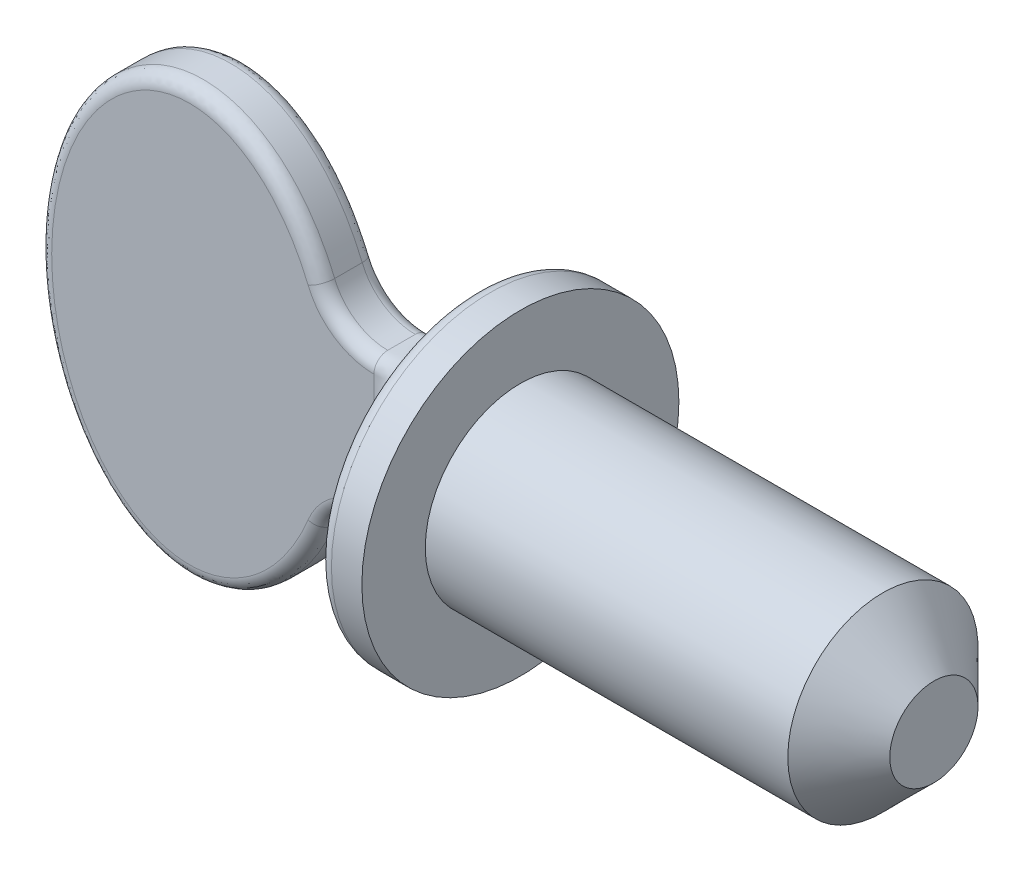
SolidWorks part; units mm, degrees
ref_plane "Front Plane" through (0, 0, 0) normal (0, 0, 1) x (1, 0, 0)
ref_plane "Top Plane" through (0, 0, 0) normal (0, 1, 0) x (1, 0, 0)
ref_plane "Right Plane" through (0, 0, 0) normal (1, 0, 0) x (0, 0, -1)
sketch "layout" plane through (0, 0, 0) normal (0, 0, 1) x (1, 0, 0)
  line L0 (0, 0) -> (13.208, 0) construction
  line L1 (5.588, 2.921) -> (5.588, -2.921)
  line L2 (3.3976, 1.3123) -> (4.8921, 1.3123) construction
  line L3 (5.588, 2.921) -> (4.7897, 2.921)
  line L4 (4.7897, 2.921) -> (4.7897, 3.2655) construction
  line L5 (4.2865, 1.706) -> (4.2865, 0)
  line L6 (4.2865, 1.706) -> (3.3355, 0.7551) construction
  line L7 (13.208, 1.7526) -> (13.208, 0)
  line L8 (3.3976, 1.3123) -> (3.3976, -1.3123)
  line L9 (13.208, 1.7526) -> (5.588, 1.7526)
  arc A0 (3.3976, 1.3123) -> (2.4197, 1.9685) centre (3.3976, 2.3692) cw
  arc A1 (4.7897, 2.921) -> (4.2865, 1.706) centre (3.0715, 2.921) cw
  arc A2 (3.3976, -1.3123) -> (2.4197, -1.9685) centre (3.3976, -2.3692) ccw
  ellipse E0 centre (0, 0) end of major axis (0, 3.937) minor radius 2.794 (2.4197, 1.9685) -> (2.4197, -1.9685) ccw
sketch "Sketch3" plane through (0, 0, 0) normal (0, 0, 1) x (1, 0, 0)
  line L0 (3.3976, 1.3123) -> (3.3976, -1.3123) construction
  line L1 (3.3976, 1.3123) -> (3.3976, -1.3123)
  arc A0 (3.3976, -1.3123) -> (2.4197, -1.9685) centre (3.3976, -2.3692) ccw construction
  arc A1 (2.4197, 1.9685) -> (3.3976, 1.3123) centre (3.3976, 2.3692) ccw construction
  arc A2 (3.3976, -1.3123) -> (2.4197, -1.9685) centre (3.3976, -2.3692) ccw
  arc A3 (2.4197, 1.9685) -> (3.3976, 1.3123) centre (3.3976, 2.3692) ccw
  ellipse E0 centre (0, 0) end of major axis (0, 3.937) minor radius 2.794 (2.4197, 1.9685) -> (2.4197, -1.9685) ccw construction
  ellipse E1 centre (0, 0) end of major axis (0, 3.937) minor radius 2.794 (2.4197, 1.9685) -> (2.4197, -1.9685) ccw
extrude "Extrude1" add sketch "Sketch3" along normal mid plane 1.016
fillet "Fillet1" radius 0.254 6 edges at (2.8088, 1.4916, -0.508) (2.8088, -1.4916, -0.508) (2.8088, 1.4916, 0.508) (2.8088, -1.4916, 0.508) (-2.794, 0, -0.508) (-2.794, 0, 0.508)
sketch "Sketch4" plane through (0, 0, 0) normal (0, 0, 1) x (1, 0, 0)
  line L0 (13.208, 1.7526) -> (13.208, 0) construction
  line L1 (13.208, 1.7526) -> (5.588, 1.7526) construction
  line L2 (5.588, 2.921) -> (5.588, -2.921) construction
  line L3 (5.588, 2.921) -> (4.7897, 2.921) construction
  line L4 (4.2865, 1.706) -> (4.2865, 0) construction
  line L5 (13.208, 0.8128) -> (13.208, 0)
  line L6 (12.2682, 1.7526) -> (5.588, 1.7526)
  line L7 (5.588, 2.921) -> (5.588, 1.7526)
  line L8 (5.588, 2.921) -> (4.7897, 2.921)
  line L9 (4.2865, 1.706) -> (4.2865, 0)
  line L10 (0, 0) -> (16.8942, 0) construction
  line L11 (13.208, 0) -> (4.2865, 0)
  line L12 (12.2682, 1.7526) -> (13.208, 0.8128)
  line L15 (12.2682, -1.7526) -> (13.208, -0.8128) construction
  arc A0 (4.2865, 1.706) -> (4.7897, 2.921) centre (3.0715, 2.921) ccw construction
  arc A1 (4.2865, 1.706) -> (4.7897, 2.921) centre (3.0715, 2.921) ccw
revolve "Revolve1" add sketch "Sketch4" angle 360 about L10
loft "Loft1" add
fillet "Fillet2" radius 0.254 1 edges at (4.7897, 0, 2.921)
sketch "Sketch5" plane through (0, 0, 0) normal (0, 1, 0) x (1, 0, 0)
  line L0 (11.7227, 2.2981) -> (12.2682, 2.2981)
  line L1 (12.2682, 2.2981) -> (12.2682, 1.7526)
  line L2 (12.2682, 1.7526) -> (11.9954, 1.2802)
  line L3 (11.9954, 1.2802) -> (11.7227, 1.7526)
  line L5 (11.7227, 1.7526) -> (11.7227, 2.2981)
  line L7 (-3.6147, 0) -> (14.1406, 0) construction
revolve "Cut-Revolve10" [suppressed] cut sketch "Sketch5" angle 360 about L7
pattern_linear "LPattern10" [suppressed] count 8 along (1, 0, 0)
equation "\"D4@layout\" = \"Head Height@layout\" / 3 * 2"
equation "\"D5@layout\" = \"Head Width@layout\" / 3"
equation "\"D6@layout\" = \"Head Width@layout\" / 2"
equation "\"D7@layout\" = \"D5@layout\" * 1.3"
equation "\"D8@layout\" = \"D4@layout\"  / 7"
equation "\"D1@Fillet1\" = \"Head Thickness@Extrude1\" / 4"
equation "\"D1@Fillet2\" = \"D1@Fillet1\""
equation "\"D1@Sketch5\" = ( \"Base Screw Dia@layout\"- \"Minor Dia@Cosmetic Thread1\" )  / 2"
equation "\"D1@LPattern10\" = int((\"Length@layout\"-\"O@Sketch4\"/2)/\"Advance@LPattern10\")"
